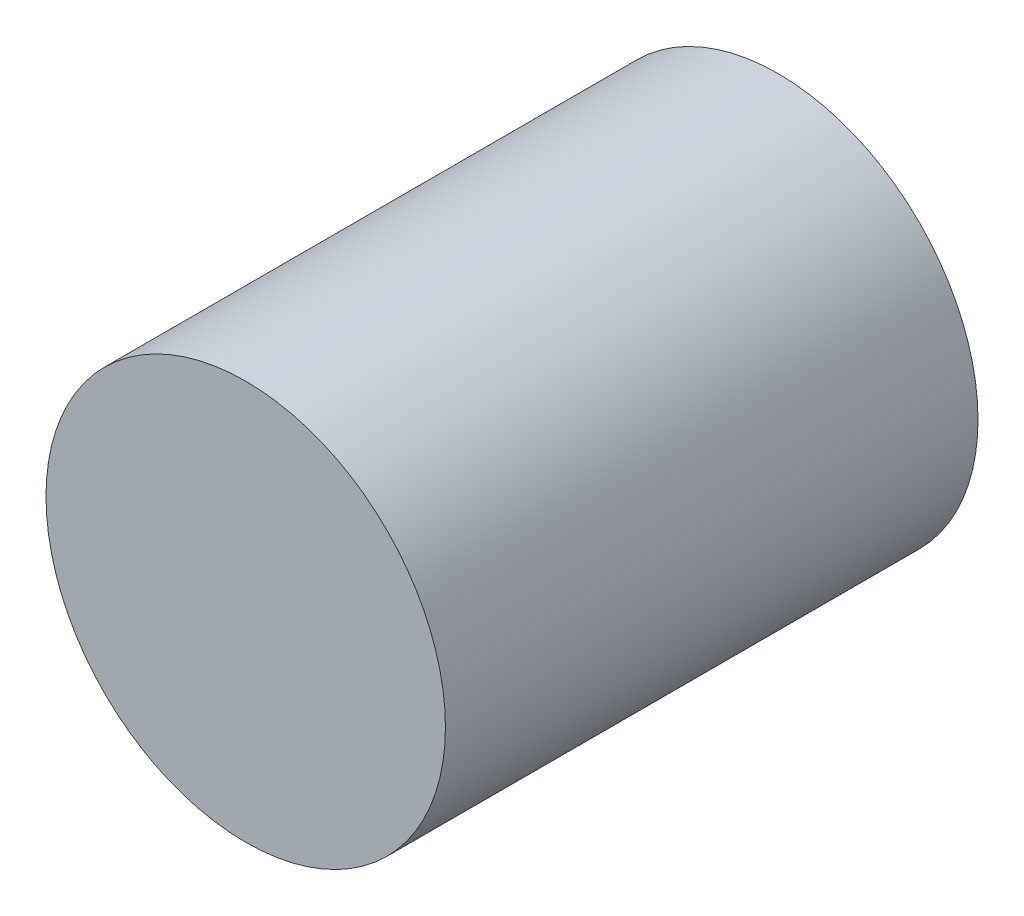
SolidWorks part; units mm, degrees
ref_plane "Front Plane" through (0, 0, 0) normal (0, 0, 1) x (1, 0, 0)
ref_plane "Top Plane" through (0, 0, 0) normal (0, 1, 0) x (1, 0, 0)
ref_plane "Right Plane" through (0, 0, 0) normal (1, 0, 0) x (0, 0, -1)
sketch "Sketch1" plane through (0, 0, 0) normal (0, 0, 1) x (1, 0, 0)
  circle A0 centre (0, 0) radius 15
  dimension "D1" = 30
extrude "Extrude1" add sketch "Sketch1" against normal blind 40
